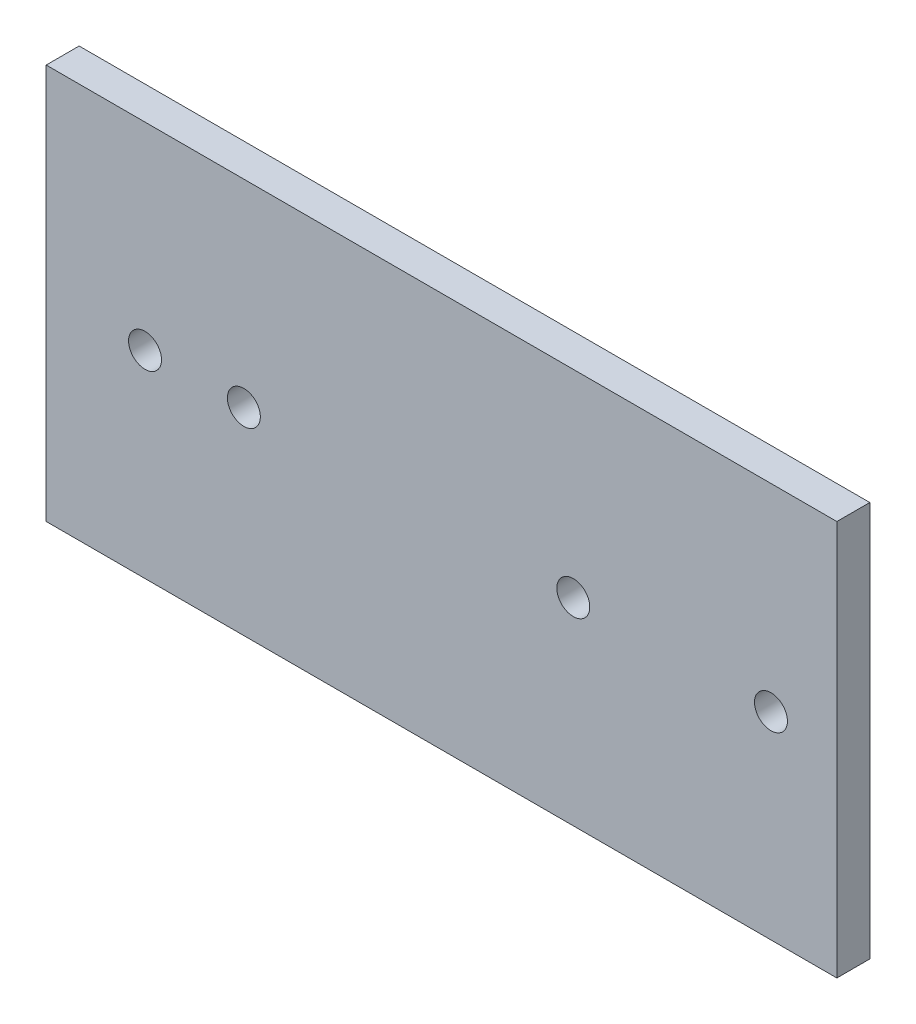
SolidWorks part; units mm, degrees
ref_plane "Front Plane" through (0, 0, 0) normal (0, 0, 1) x (1, 0, 0)
ref_plane "Top Plane" through (0, 0, 0) normal (0, 1, 0) x (1, 0, 0)
ref_plane "Right Plane" through (0, 0, 0) normal (1, 0, 0) x (0, 0, -1)
sketch "Sketch1" plane through (0, 0, 0) normal (0, 0, 1) x (1, 0, 0)
  line L1 (-60, -30) -> (60, -30)
  line L2 (-60, -30) -> (-60, 30)
  line L3 (-60, 30) -> (60, 30)
  line L4 (60, -30) -> (60, 30)
  line L5 (-60, -30) -> (60, 30) construction
  line L6 (-60, 30) -> (60, -30) construction
  point P0 (0, 0)
  dimension "D1" = 120
  dimension "D2" = 60
extrude "Boss-Extrude1" add sketch "Sketch1" along normal blind 5 contours L3 L4 L1 L2
hole_wizard "M6x1.0 Tapped Hole1" positions "Sketch3" profile "Sketch2" tap size "M6x1.0" standard "ANSI Metric"
sketch "Sketch3" plane through (0, 0, 0) normal (0, 0, -1) x (-1, 0, 0)
  line L0 (-60, 0) -> (60, 0) construction
  line L1 (-60, -30) -> (-60, 30) construction
  line L2 (60, -30) -> (60, 30) construction
  point P0 (-50, 0)
  point P2 (-20, 0)
  point P4 (30, 0)
  point P33 (45, 0)
  dimension "D1" = 30
  dimension "D2" = 50
  dimension "D3" = 30
  dimension "D4" = 15
sketch "Sketch2" plane through (50, 0, 0) normal (1, 0, 0) x (0, 1, 0)
  line L0 (0, 0) -> (0, 5)
  line L1 (0, 5) -> (2.5, 5)
  line L2 (2.5, 5) -> (2.5, 0)
  line L5 (2.5, 0) -> (0, 0)
  line L11 (0, -6.35) -> (0, 107.95) construction
  dimension "Thru Tap Drill Dia." = 5
  dimension "Thru Tap Drill Depth" = 5
